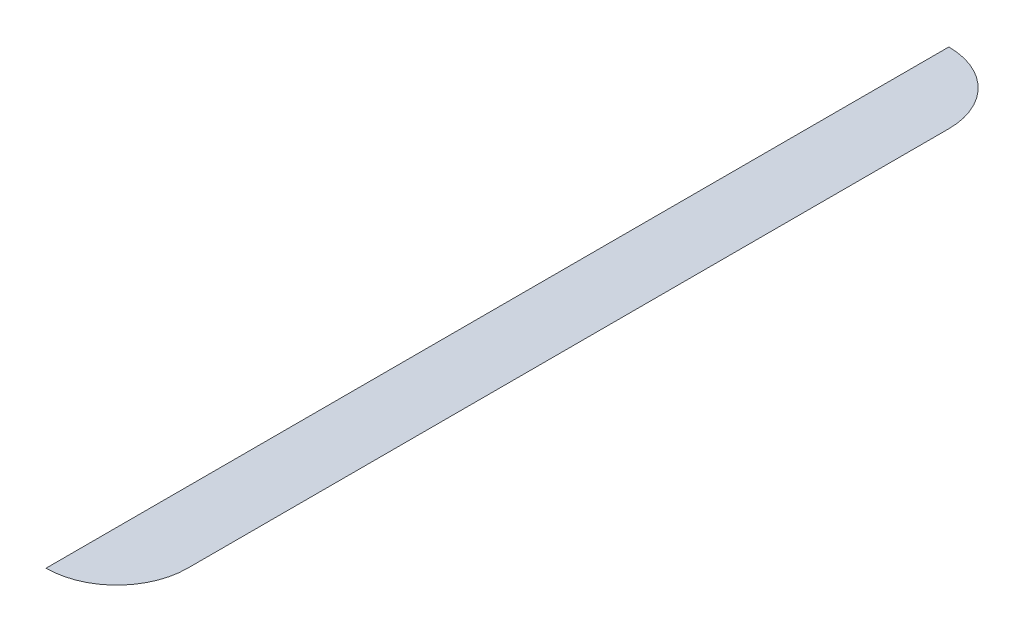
SolidWorks part; units mm, degrees
ref_plane "Plane1" through (0, 0, 0) normal (0, 0, 1) x (1, 0, 0)
ref_plane "Plane2" through (0, 0, 0) normal (0, 1, 0) x (1, 0, 0)
ref_plane "Plane3" through (0, 0, 0) normal (1, 0, 0) x (0, 0, -1)
sketch "Sketch1" plane through (0, 0, 0) normal (0, 0, 1) x (1, 0, 0)
  line L0 (-15, 0) -> (15, 0)
  line L1 (-15, 0) -> (-15, 3.4642)
  line L2 (15, 3.4642) -> (-15, 3.4642)
  line L3 (15, 3.4642) -> (15, 0)
  line L4 (0, 0) -> (0, 3.4642) construction
  line L5 (50, 0) -> (-50, 0) construction
  dimension "D1" = 30
extrude "Base-Extrude" add sketch "Sketch1" along normal mid plane 76.2
sketch "Layout Sketch" plane through (0, 0, 0) normal (0, -1, 0) x (1, 0, 0)
  line L0 (-6.5173, 0) -> (7.2244, 0) construction
  line L1 (11.2638, 0) -> (-11.2638, 0) construction
  line L2 (0, 9.1132) -> (0, -7.6236) construction
  line L3 (0, -50) -> (0, 50) construction
  line L9 (-5.4737, -23.6474) -> (-5.4737, 23.6474)
  line L11 (5.4737, 12.7) -> (5.4737, -12.7)
  arc A0 (5.4737, 12.7) -> (-5.4737, 23.6474) centre (-5.4737, 12.7) ccw
  arc A1 (5.4737, -12.7) -> (-5.4737, -23.6474) centre (-5.4737, -12.7) cw
  dimension "Overall width" = 47.2948
  dimension "Depth" = 10.9474
sketch "Louver Body" plane through (0, 0, 0) normal (0, 0, 1) x (1, 0, 0)
  line L0 (-5.4737, 0) -> (-5.4737, -4.826)
  line L1 (-15, 0) -> (15, 0) construction
  line L2 (-5.4737, 0) -> (5.4737, 0)
  line L4 (5.4737, 0) -> (5.4737, 3.4642) construction
  line L5 (15, 3.4642) -> (-15, 3.4642) construction
  line L6 (-5.4737, -4.826) -> (-3.0249, -4.826) construction
  line L8 (0, 3.4642) -> (0, 0) construction
  arc A0 (-5.4737, -4.826) -> (5.4737, 0) centre (-1.0637, 0) ccw construction
  arc A1 (5.4737, 0) -> (-5.4737, -4.826) centre (-5.4737, 10.0037) cw
  dimension "D1" = 4.826
extrude "Boss-Extrude1" add sketch "Louver Body" along normal mid plane 25.4
sketch "Sketch12" plane through (0, 0, 12.7) normal (0, 0, 1) x (1, 0, 0)
  line L0 (-5.4737, 0) -> (-5.4737, -4.826) construction
  line L1 (-5.4737, 0) -> (-5.4737, -4.826) construction
  line L2 (-15, 0) -> (15, 0) construction
  line L5 (5.4737, 0) -> (-5.4737, 0)
  line L6 (-5.4737, 0) -> (-5.4737, -4.826)
  line L7 (5.4737, 0) -> (-5.4737, 0)
  line L8 (-5.4737, 0) -> (-5.4737, -4.826)
  arc A2 (-5.4737, -4.826) -> (5.4737, 0) centre (-5.4737, 10.0037) ccw
  arc A3 (-5.4737, -4.826) -> (5.4737, 0) centre (-5.4737, 10.0037) ccw
  dimension "D1" = 0
revolve "Boss-Revolve2" add sketch "Sketch12" angle 90 about L1
sketch "Sketch13" plane through (0, 0, -12.7) normal (0, 0, -1) x (-1, 0, 0)
  line L0 (5.4737, -4.826) -> (5.4737, 0) construction
  line L1 (15, 0) -> (-15, 0) construction
  line L2 (5.4737, 0) -> (-5.4737, 0)
  line L3 (5.4737, -4.826) -> (5.4737, 0)
  line L4 (5.4737, 0) -> (-5.4737, 0)
  line L5 (5.4737, -4.826) -> (5.4737, 0)
  arc A1 (-5.4737, 0) -> (5.4737, -4.826) centre (5.4737, 10.0037) ccw
  arc A2 (-5.4737, 0) -> (5.4737, -4.826) centre (5.4737, 10.0037) ccw
  dimension "D1" = 0
revolve "Boss-Revolve3" add sketch "Sketch13" angle 90 about L0
fillet "Fillet1" radius 2.0574 3 edges at (5.4737, 0, 0) (2.2673, 0, 20.441) (2.2673, 0, -20.441)
sketch "Sketch8" plane through (-15, 0, 0) normal (-1, 0, 0) x (0, 0, 1)
  line L4 (-38.1, 0) -> (38.1, 0)
  line L5 (38.1, 0) -> (38.1, 3.4642)
  line L6 (38.1, 3.4642) -> (-38.1, 3.4642)
  line L7 (-38.1, 3.4642) -> (-38.1, 0)
  line L8 (-38.1, 0) -> (38.1, 0)
  line L9 (38.1, 0) -> (38.1, 3.4642)
  line L10 (38.1, 3.4642) -> (-38.1, 3.4642)
  line L11 (-38.1, 3.4642) -> (-38.1, 0)
  dimension "D1" = 0
extrude "Cut-Extrude4" cut sketch "Sketch8" against normal through all
sketch "Orientation sketch" plane through (0, 0, 0) normal (0, 1, 0) x (-1, 0, 0)
  line L2 (5.4737, 24.5196) -> (5.4737, -24.5196)
  line L3 (5.4737, 24.5196) -> (5.4737, -24.5196)
  line L4 (-6.3459, 12.7) -> (-6.3459, -12.7)
  line L5 (-6.3459, 12.7) -> (-6.3459, -12.7)
  arc A2 (5.4737, 24.5196) -> (-6.3459, 12.7) centre (5.4737, 12.7) ccw
  arc A3 (5.4737, 24.5196) -> (-6.3459, 12.7) centre (5.4737, 12.7) ccw
  arc A4 (-6.3459, -12.7) -> (5.4737, -24.5196) centre (5.4737, -12.7) ccw
  arc A5 (-6.3459, -12.7) -> (5.4737, -24.5196) centre (5.4737, -12.7) ccw
  dimension "D1" = 0
other "Move Face1" parameters "D1"=50.8
other "Move Face2" parameters "D1"=50.8, "Width"=25.4
equation "\"Width@Boss-Extrude1\"=\"Overall width@Layout Sketch\"-2*\"Depth@Layout Sketch\""
